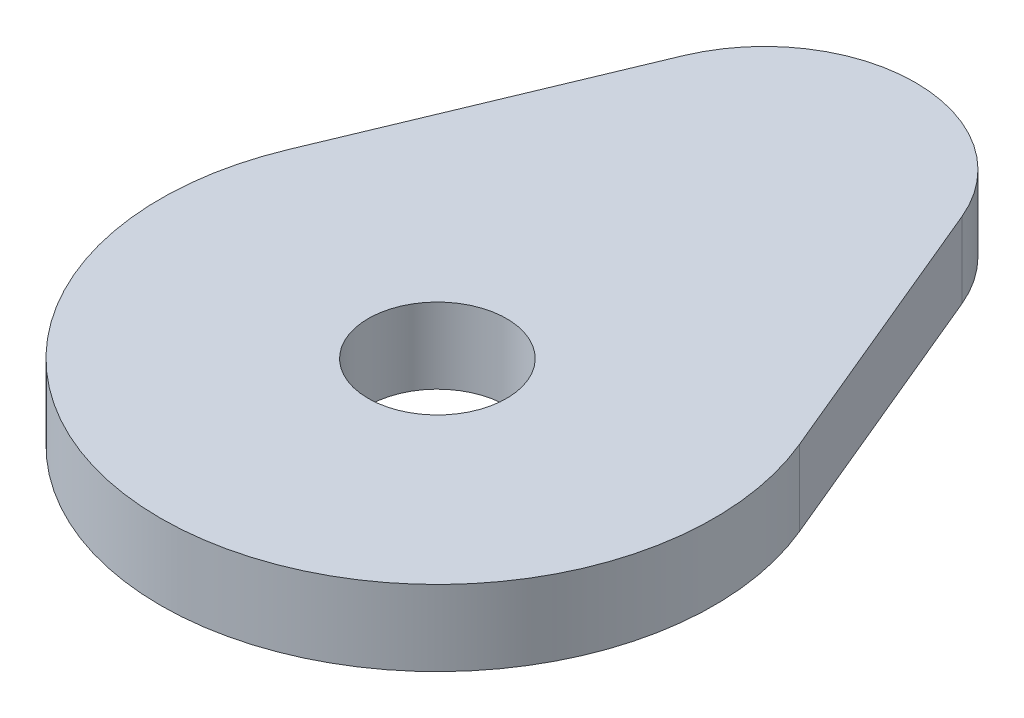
SolidWorks part; units mm, degrees
ref_plane "Front" through (0, 0, 0) normal (0, 0, 1) x (1, 0, 0)
ref_plane "Top" through (0, 0, 0) normal (0, 1, 0) x (1, 0, 0)
ref_plane "Right" through (0, 0, 0) normal (1, 0, 0) x (0, 0, -1)
sketch "Sketch1" plane through (0, 0, 0) normal (0, 1, 0) x (1, 0, 0)
  line L1 (5.5385, 15.3077) -> (10.1538, 4.2308)
  line L2 (-5.5385, 15.3077) -> (-10.1538, 4.2308)
  circle A0 centre (0, 0) radius 2.75
  arc A1 (-10.1538, 4.2308) -> (10.1538, 4.2308) centre (0, 0) ccw
  arc A2 (5.5385, 15.3077) -> (-5.5385, 15.3077) centre (0, 13) ccw
extrude "Extrude1" add sketch "Sketch1" along normal blind 3
